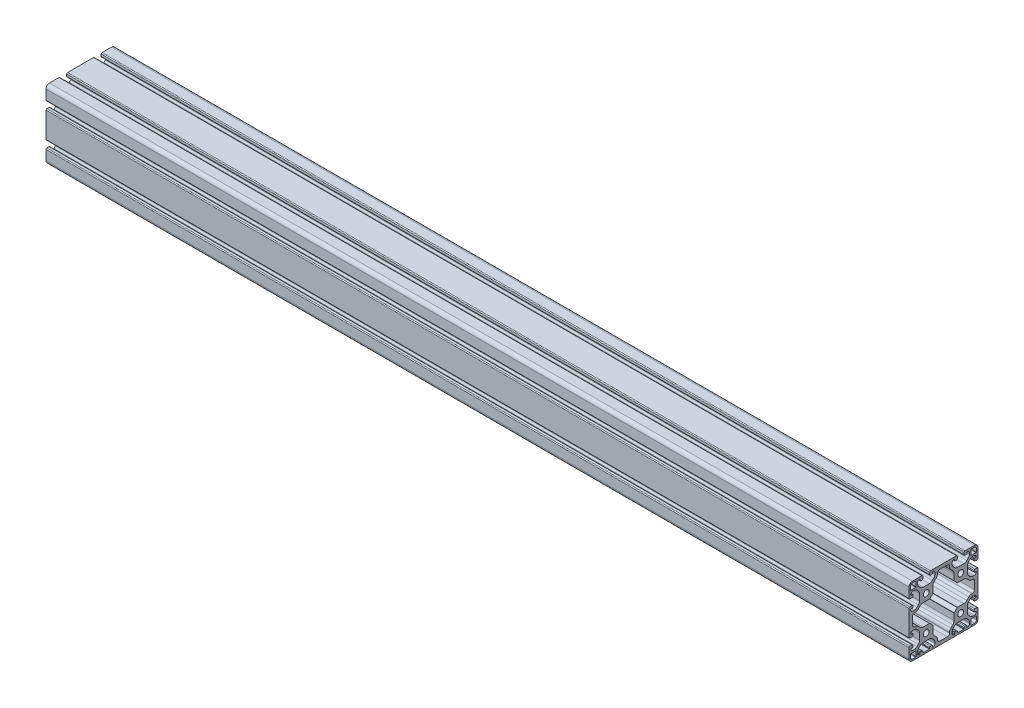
SolidWorks part; units mm, degrees
ref_plane "Ebene vorne" through (0, 0, 0) normal (0, 0, 1) x (1, 0, 0)
ref_plane "Ebene oben" through (0, 0, 0) normal (0, 1, 0) x (1, 0, 0)
ref_plane "Ebene rechts" through (0, 0, 0) normal (1, 0, 0) x (0, 0, -1)
sketch "Skizze1" plane through (0, 0, 0) normal (0, 1, 0) x (1, 0, 0)
  line L0 (0, 0) -> (1000, 0)
  dimension "D1" = 1000
other "Strukturbauteil1"
ref_plane "Ebene1" through (0, 0, 0) normal (1, 0, 0) x (0, 0, -1)
sketch "Skizze14" plane through (0, 0, 0) normal (1, 0, 0) x (0, 0, -1)
  line L0 (-37.5, -23.6736) -> (-39, -23.6736)
  line L1 (-37.5, -15.6736) -> (-39, -15.6736)
  line L2 (-37.5, 23.7652) -> (-39, 23.7652)
  line L3 (-37.5, 15.7652) -> (-39, 15.7652)
  line L4 (-40, -24.6736) -> (-40, -36)
  line L5 (-40, 14.7652) -> (-40, -14.6736)
  line L8 (-38.2, 36) -> (-38.2, 32.3)
  line L9 (-32.3, 38.2) -> (-36, 38.2)
  line L10 (-31.8, 32.3) -> (-31.8, 37.7)
  line L11 (-37.7, 31.8) -> (-32.3, 31.8)
  line L24 (-36, -26.6736) -> (-37.5, -26.6736)
  line L25 (-35.5, -24.6736) -> (-35.5, -26.1736)
  line L26 (-37.5, -23.6736) -> (-36.5, -23.6736)
  line L28 (-36.5, -15.6736) -> (-37.5, -15.6736)
  line L29 (-35.5, -13.1736) -> (-35.5, -14.6736)
  line L30 (-37.5, -12.6736) -> (-36, -12.6736)
  line L31 (-34.1924, -9.6736) -> (-35.5, -9.6736)
  line L120 (-36, -40) -> (36, -40)
  line L121 (40, -36) -> (40, -25)
  line L122 (39, -24) -> (36.5, -24)
  line L123 (35.5, -25) -> (35.5, -26.5)
  line L124 (36, -27) -> (37.55, -27)
  line L125 (38, -27.45) -> (38, -27.5)
  line L126 (35.5, -30) -> (34.1924, -30)
  line L127 (30.6569, -28.5355) -> (29.2145, -27.0931)
  line L128 (27.75, -23.5576) -> (27.75, -16.4424)
  line L129 (29.2145, -12.9069) -> (30.6569, -11.4645)
  line L130 (34.1924, -10) -> (35.5, -10)
  line L131 (38, -12.5) -> (38, -12.55)
  line L132 (37.55, -13) -> (36, -13)
  line L133 (35.5, -13.5) -> (35.5, -15)
  line L134 (36.5, -16) -> (39, -16)
  line L135 (40, -15) -> (40, 15)
  line L136 (39, 16) -> (36.5, 16)
  line L137 (35.5, 15) -> (35.5, 13.5)
  line L138 (36, 13) -> (37.55, 13)
  line L139 (38, 12.55) -> (38, 12.5)
  line L140 (35.5, 10) -> (34.1924, 10)
  line L141 (30.6569, 11.4645) -> (29.2145, 12.9069)
  line L142 (27.75, 16.4424) -> (27.75, 23.5576)
  line L143 (29.2145, 27.0931) -> (30.6569, 28.5355)
  line L144 (34.1924, 30) -> (35.5, 30)
  line L145 (38, 27.5) -> (38, 27.45)
  line L146 (37.55, 27) -> (36, 27)
  line L147 (35.5, 26.5) -> (35.5, 25)
  line L148 (36.5, 24) -> (39, 24)
  line L149 (40, 25) -> (40, 36)
  line L150 (36, 40) -> (25, 40)
  line L151 (24, 39) -> (24, 36.5)
  line L152 (25, 35.5) -> (26.5, 35.5)
  line L153 (27, 36) -> (27, 37.55)
  line L154 (27.45, 38) -> (27.5, 38)
  line L155 (30, 35.5) -> (30, 34.1924)
  line L156 (28.5355, 30.6569) -> (27.0931, 29.2145)
  line L157 (23.5576, 27.75) -> (16.4424, 27.75)
  line L158 (12.9069, 29.2145) -> (11.4645, 30.6569)
  line L159 (10, 34.1924) -> (10, 35.5)
  line L160 (12.5, 38) -> (12.55, 38)
  line L161 (13, 37.55) -> (13, 36)
  line L162 (13.5, 35.5) -> (15, 35.5)
  line L163 (16, 36.5) -> (16, 39)
  line L164 (15, 40) -> (-15, 40)
  line L165 (-16, 39) -> (-16, 36.5)
  line L166 (-15, 35.5) -> (-13.5, 35.5)
  line L167 (-13, 36) -> (-13, 37.55)
  line L168 (-12.55, 38) -> (-12.5, 38)
  line L169 (-10, 35.5) -> (-10, 34.1924)
  line L170 (-11.4645, 30.6569) -> (-12.9069, 29.2145)
  line L171 (-16.4424, 27.75) -> (-23.5576, 27.75)
  line L172 (-27.0931, 29.2145) -> (-28.5355, 30.6569)
  line L173 (-30, 34.1924) -> (-30, 35.5)
  line L174 (-27.5, 38) -> (-27.45, 38)
  line L175 (-27, 37.55) -> (-27, 36)
  line L176 (-26.5, 35.5) -> (-25, 35.5)
  line L177 (-24, 36.5) -> (-24, 39)
  line L178 (-25, 40) -> (-36, 40)
  line L179 (-40, 36) -> (-40, 24.7652)
  line L184 (-32.9497, 7) -> (-33.5, 7)
  line L185 (-27.0931, 10.7855) -> (-29.4142, 8.4645)
  line L186 (-16.2414, 12.25) -> (-23.5576, 12.25)
  line L187 (-12.3964, 15.8878) -> (-15.8878, 12.3964)
  line L188 (-12.25, 23.5576) -> (-12.25, 16.2414)
  line L189 (-8.4645, 29.4142) -> (-10.7855, 27.0931)
  line L190 (-7, 33.5) -> (-7, 32.9497)
  line L191 (4.5, 36) -> (-4.5, 36)
  line L192 (7, 32.9497) -> (7, 33.5)
  line L193 (10.7855, 27.0931) -> (8.4645, 29.4142)
  line L194 (12.25, 16.2414) -> (12.25, 23.5576)
  line L195 (15.8878, 12.3964) -> (12.3964, 15.8878)
  line L196 (23.5576, 12.25) -> (16.2414, 12.25)
  line L197 (29.4142, 8.4645) -> (27.0931, 10.7855)
  line L198 (33.5, 7) -> (32.9497, 7)
  line L199 (36, -4.5) -> (36, 4.5)
  line L200 (32.9497, -7) -> (33.5, -7)
  line L201 (27.0931, -10.7855) -> (29.4142, -8.4645)
  line L202 (16.2414, -12.25) -> (23.5576, -12.25)
  line L203 (12.3964, -15.8878) -> (15.8878, -12.3964)
  line L204 (12.25, -23.5576) -> (12.25, -16.2414)
  line L205 (8.4645, -29.4142) -> (10.7855, -27.0931)
  line L206 (7, -33.5) -> (7, -32.9497)
  line L207 (-4.5, -36) -> (4.5, -36)
  line L208 (-7, -32.9497) -> (-7, -33.5)
  line L209 (-10.7855, -27.0931) -> (-8.4645, -29.4142)
  line L210 (-12.25, -16.2414) -> (-12.25, -23.5576)
  line L211 (-15.8878, -12.3964) -> (-12.3964, -15.8878)
  line L212 (-23.5576, -12.25) -> (-16.2414, -12.25)
  line L213 (-29.4142, -8.4645) -> (-27.0931, -10.7855)
  line L214 (-33.5, -7) -> (-32.9497, -7)
  line L215 (-36, 4.5) -> (-36, -4.5)
  line L216 (-29.2145, -12.5805) -> (-30.6569, -11.1381)
  line L217 (-27.75, -23.2312) -> (-27.75, -16.116)
  line L218 (-30.6569, -28.2091) -> (-29.2145, -26.7668)
  line L219 (-35.5, -29.6736) -> (-34.1924, -29.6736)
  line L232 (-36, 12.7652) -> (-37.5, 12.7652)
  line L233 (-35.5, 14.7652) -> (-35.5, 13.2652)
  line L234 (-37.5, 15.7652) -> (-36.5, 15.7652)
  line L236 (-36.5, 23.7652) -> (-37.5, 23.7652)
  line L237 (-35.5, 26.2652) -> (-35.5, 24.7652)
  line L238 (-37.5, 26.7652) -> (-36, 26.7652)
  line L239 (-34.1924, 29.7652) -> (-35.5, 29.7652)
  line L240 (-29.2145, 26.8584) -> (-30.6569, 28.3008)
  line L241 (-27.75, 16.2076) -> (-27.75, 23.3229)
  line L242 (-30.6569, 11.2297) -> (-29.2145, 12.6721)
  line L243 (-35.5, 9.7652) -> (-34.1924, 9.7652)
  line L248 (-32.3, -31.8) -> (-37.7, -31.8)
  line L249 (-31.8, -37.7) -> (-31.8, -32.3)
  line L250 (-36, -38.2) -> (-32.3, -38.2)
  line L251 (-38.2, -32.3) -> (-38.2, -36)
  line L256 (31.8, -32.3) -> (31.8, -37.7)
  line L257 (37.7, -31.8) -> (32.3, -31.8)
  line L258 (38.2, -36) -> (38.2, -32.3)
  line L259 (32.3, -38.2) -> (36, -38.2)
  line L272 (10, -34.1924) -> (10, -35.5)
  line L273 (12.9069, -29.2145) -> (11.4645, -30.6569)
  line L274 (23.5576, -27.75) -> (16.4424, -27.75)
  line L275 (28.5355, -30.6569) -> (27.0931, -29.2145)
  line L276 (30, -35.5) -> (30, -34.1924)
  line L277 (27, -36) -> (27, -37.5)
  line L278 (25, -35.5) -> (26.5, -35.5)
  line L279 (24, -37.5) -> (24, -36.5)
  line L280 (16.5, -38) -> (23.5, -38)
  line L281 (16, -36.5) -> (16, -37.5)
  line L282 (13.5, -35.5) -> (15, -35.5)
  line L283 (13, -37.5) -> (13, -36)
  line L296 (-30, -34.1924) -> (-30, -35.5)
  line L297 (-27.0931, -29.2145) -> (-28.5355, -30.6569)
  line L298 (-16.4424, -27.75) -> (-23.5576, -27.75)
  line L299 (-11.4645, -30.6569) -> (-12.9069, -29.2145)
  line L300 (-10, -35.5) -> (-10, -34.1924)
  line L301 (-13, -36) -> (-13, -37.5)
  line L302 (-15, -35.5) -> (-13.5, -35.5)
  line L303 (-16, -37.5) -> (-16, -36.5)
  line L304 (-23.5, -38) -> (-16.5, -38)
  line L305 (-24, -36.5) -> (-24, -37.5)
  line L306 (-26.5, -35.5) -> (-25, -35.5)
  line L307 (-27, -37.5) -> (-27, -36)
  line L312 (31.8, 37.7) -> (31.8, 32.3)
  line L313 (36, 38.2) -> (32.3, 38.2)
  line L314 (38.2, 32.3) -> (38.2, 36)
  line L315 (32.3, 31.8) -> (37.7, 31.8)
  arc A0 (-39, 15.7652) -> (-40, 14.7652) centre (-39, 14.7652) ccw
  arc A1 (-39, 23.7652) -> (-40, 24.7652) centre (-39, 24.7652) cw
  circle A2 centre (20, 20) radius 3.4
  arc A3 (-39, -23.6736) -> (-40, -24.6736) centre (-39, -24.6736) ccw
  circle A4 centre (-20, 20) radius 3.4
  arc A5 (-39, -15.6736) -> (-40, -14.6736) centre (-39, -14.6736) cw
  circle A6 centre (-20, -20) radius 3.4
  circle A8 centre (20, -20) radius 3.4
  arc A16 (-38.2, 32.3) -> (-37.7, 31.8) centre (-37.7, 32.3) ccw
  arc A17 (-36, 38.2) -> (-38.2, 36) centre (-36, 36) ccw
  arc A18 (-31.8, 37.7) -> (-32.3, 38.2) centre (-32.3, 37.7) ccw
  arc A19 (-32.3, 31.8) -> (-31.8, 32.3) centre (-32.3, 32.3) ccw
  arc A120 (-40, -36) -> (-36, -40) centre (-36, -36) ccw
  arc A121 (36, -40) -> (40, -36) centre (36, -36) ccw
  arc A122 (40, -25) -> (39, -24) centre (39, -25) ccw
  arc A123 (36.5, -24) -> (35.5, -25) centre (36.5, -25) ccw
  arc A124 (35.5, -26.5) -> (36, -27) centre (36, -26.5) ccw
  arc A125 (38, -27.45) -> (37.55, -27) centre (37.55, -27.45) ccw
  arc A126 (35.5, -30) -> (38, -27.5) centre (35.5, -27.5) ccw
  arc A127 (30.6569, -28.5355) -> (34.1924, -30) centre (34.1924, -25) ccw
  arc A128 (27.75, -23.5576) -> (29.2145, -27.0931) centre (32.75, -23.5576) ccw
  arc A129 (29.2145, -12.9069) -> (27.75, -16.4424) centre (32.75, -16.4424) ccw
  arc A130 (34.1924, -10) -> (30.6569, -11.4645) centre (34.1924, -15) ccw
  arc A131 (38, -12.5) -> (35.5, -10) centre (35.5, -12.5) ccw
  arc A132 (37.55, -13) -> (38, -12.55) centre (37.55, -12.55) ccw
  arc A133 (36, -13) -> (35.5, -13.5) centre (36, -13.5) ccw
  arc A134 (35.5, -15) -> (36.5, -16) centre (36.5, -15) ccw
  arc A135 (39, -16) -> (40, -15) centre (39, -15) ccw
  arc A136 (40, 15) -> (39, 16) centre (39, 15) ccw
  arc A137 (36.5, 16) -> (35.5, 15) centre (36.5, 15) ccw
  arc A138 (35.5, 13.5) -> (36, 13) centre (36, 13.5) ccw
  arc A139 (38, 12.55) -> (37.55, 13) centre (37.55, 12.55) ccw
  arc A140 (35.5, 10) -> (38, 12.5) centre (35.5, 12.5) ccw
  arc A141 (30.6569, 11.4645) -> (34.1924, 10) centre (34.1924, 15) ccw
  arc A142 (27.75, 16.4424) -> (29.2145, 12.9069) centre (32.75, 16.4424) ccw
  arc A143 (29.2145, 27.0931) -> (27.75, 23.5576) centre (32.75, 23.5576) ccw
  arc A144 (34.1924, 30) -> (30.6569, 28.5355) centre (34.1924, 25) ccw
  arc A145 (38, 27.5) -> (35.5, 30) centre (35.5, 27.5) ccw
  arc A146 (37.55, 27) -> (38, 27.45) centre (37.55, 27.45) ccw
  arc A147 (36, 27) -> (35.5, 26.5) centre (36, 26.5) ccw
  arc A148 (35.5, 25) -> (36.5, 24) centre (36.5, 25) ccw
  arc A149 (39, 24) -> (40, 25) centre (39, 25) ccw
  arc A150 (40, 36) -> (36, 40) centre (36, 36) ccw
  arc A151 (25, 40) -> (24, 39) centre (25, 39) ccw
  arc A152 (24, 36.5) -> (25, 35.5) centre (25, 36.5) ccw
  arc A153 (26.5, 35.5) -> (27, 36) centre (26.5, 36) ccw
  arc A154 (27.45, 38) -> (27, 37.55) centre (27.45, 37.55) ccw
  arc A155 (30, 35.5) -> (27.5, 38) centre (27.5, 35.5) ccw
  arc A156 (28.5355, 30.6569) -> (30, 34.1924) centre (25, 34.1924) ccw
  arc A157 (23.5576, 27.75) -> (27.0931, 29.2145) centre (23.5576, 32.75) ccw
  arc A158 (12.9069, 29.2145) -> (16.4424, 27.75) centre (16.4424, 32.75) ccw
  arc A159 (10, 34.1924) -> (11.4645, 30.6569) centre (15, 34.1924) ccw
  arc A160 (12.5, 38) -> (10, 35.5) centre (12.5, 35.5) ccw
  arc A161 (13, 37.55) -> (12.55, 38) centre (12.55, 37.55) ccw
  arc A162 (13, 36) -> (13.5, 35.5) centre (13.5, 36) ccw
  arc A163 (15, 35.5) -> (16, 36.5) centre (15, 36.5) ccw
  arc A164 (16, 39) -> (15, 40) centre (15, 39) ccw
  arc A165 (-15, 40) -> (-16, 39) centre (-15, 39) ccw
  arc A166 (-16, 36.5) -> (-15, 35.5) centre (-15, 36.5) ccw
  arc A167 (-13.5, 35.5) -> (-13, 36) centre (-13.5, 36) ccw
  arc A168 (-12.55, 38) -> (-13, 37.55) centre (-12.55, 37.55) ccw
  arc A169 (-10, 35.5) -> (-12.5, 38) centre (-12.5, 35.5) ccw
  arc A170 (-11.4645, 30.6569) -> (-10, 34.1924) centre (-15, 34.1924) ccw
  arc A171 (-16.4424, 27.75) -> (-12.9069, 29.2145) centre (-16.4424, 32.75) ccw
  arc A172 (-27.0931, 29.2145) -> (-23.5576, 27.75) centre (-23.5576, 32.75) ccw
  arc A173 (-30, 34.1924) -> (-28.5355, 30.6569) centre (-25, 34.1924) ccw
  arc A174 (-27.5, 38) -> (-30, 35.5) centre (-27.5, 35.5) ccw
  arc A175 (-27, 37.55) -> (-27.45, 38) centre (-27.45, 37.55) ccw
  arc A176 (-27, 36) -> (-26.5, 35.5) centre (-26.5, 36) ccw
  arc A177 (-25, 35.5) -> (-24, 36.5) centre (-25, 36.5) ccw
  arc A178 (-24, 39) -> (-25, 40) centre (-25, 39) ccw
  arc A179 (-36, 40) -> (-40, 36) centre (-36, 36) ccw
  arc A186 (-33.5, 7) -> (-36, 4.5) centre (-33.5, 4.5) ccw
  arc A187 (-32.9497, 7) -> (-29.4142, 8.4645) centre (-32.9497, 12) ccw
  arc A188 (-23.5576, 12.25) -> (-27.0931, 10.7855) centre (-23.5576, 7.25) ccw
  arc A189 (-16.2414, 12.25) -> (-15.8878, 12.3964) centre (-16.2414, 12.75) ccw
  arc A190 (-12.3964, 15.8878) -> (-12.25, 16.2414) centre (-12.75, 16.2414) ccw
  arc A191 (-10.7855, 27.0931) -> (-12.25, 23.5576) centre (-7.25, 23.5576) ccw
  arc A192 (-8.4645, 29.4142) -> (-7, 32.9497) centre (-12, 32.9497) ccw
  arc A193 (-4.5, 36) -> (-7, 33.5) centre (-4.5, 33.5) ccw
  arc A194 (7, 33.5) -> (4.5, 36) centre (4.5, 33.5) ccw
  arc A195 (7, 32.9497) -> (8.4645, 29.4142) centre (12, 32.9497) ccw
  arc A196 (12.25, 23.5576) -> (10.7855, 27.0931) centre (7.25, 23.5576) ccw
  arc A197 (12.25, 16.2414) -> (12.3964, 15.8878) centre (12.75, 16.2414) ccw
  arc A198 (15.8878, 12.3964) -> (16.2414, 12.25) centre (16.2414, 12.75) ccw
  arc A199 (27.0931, 10.7855) -> (23.5576, 12.25) centre (23.5576, 7.25) ccw
  arc A200 (29.4142, 8.4645) -> (32.9497, 7) centre (32.9497, 12) ccw
  arc A201 (36, 4.5) -> (33.5, 7) centre (33.5, 4.5) ccw
  arc A202 (33.5, -7) -> (36, -4.5) centre (33.5, -4.5) ccw
  arc A203 (32.9497, -7) -> (29.4142, -8.4645) centre (32.9497, -12) ccw
  arc A204 (23.5576, -12.25) -> (27.0931, -10.7855) centre (23.5576, -7.25) ccw
  arc A205 (16.2414, -12.25) -> (15.8878, -12.3964) centre (16.2414, -12.75) ccw
  arc A206 (12.3964, -15.8878) -> (12.25, -16.2414) centre (12.75, -16.2414) ccw
  arc A207 (10.7855, -27.0931) -> (12.25, -23.5576) centre (7.25, -23.5576) ccw
  arc A208 (8.4645, -29.4142) -> (7, -32.9497) centre (12, -32.9497) ccw
  arc A209 (4.5, -36) -> (7, -33.5) centre (4.5, -33.5) ccw
  arc A210 (-7, -33.5) -> (-4.5, -36) centre (-4.5, -33.5) ccw
  arc A211 (-7, -32.9497) -> (-8.4645, -29.4142) centre (-12, -32.9497) ccw
  arc A212 (-12.25, -23.5576) -> (-10.7855, -27.0931) centre (-7.25, -23.5576) ccw
  arc A213 (-12.25, -16.2414) -> (-12.3964, -15.8878) centre (-12.75, -16.2414) ccw
  arc A214 (-15.8878, -12.3964) -> (-16.2414, -12.25) centre (-16.2414, -12.75) ccw
  arc A215 (-27.0931, -10.7855) -> (-23.5576, -12.25) centre (-23.5576, -7.25) ccw
  arc A216 (-29.4142, -8.4645) -> (-32.9497, -7) centre (-32.9497, -12) ccw
  arc A217 (-36, -4.5) -> (-33.5, -7) centre (-33.4973, -4.4973) ccw
  arc A220 (-37.5, -26.6736) -> (-38, -27.1736) centre (-37.5, -27.1736) ccw
  arc A221 (-36, -26.6736) -> (-35.5, -26.1736) centre (-36, -26.1736) ccw
  arc A222 (-35.5, -24.6736) -> (-36.5, -23.6736) centre (-36.5, -24.6736) ccw
  arc A225 (-36.5, -15.6736) -> (-35.5, -14.6736) centre (-36.5, -14.6736) ccw
  arc A226 (-35.5, -13.1736) -> (-36, -12.6736) centre (-36, -13.1736) ccw
  arc A227 (-38, -12.1736) -> (-37.5, -12.6736) centre (-37.5, -12.1736) ccw
  arc A228 (-35.5, -9.6736) -> (-38, -12.1736) centre (-35.5, -12.1736) ccw
  arc A229 (-30.6569, -11.1381) -> (-34.1924, -9.6736) centre (-34.1924, -14.6736) ccw
  arc A230 (-27.75, -16.116) -> (-29.2145, -12.5805) centre (-32.75, -16.116) ccw
  arc A231 (-29.2145, -26.7668) -> (-27.75, -23.2312) centre (-32.75, -23.2312) ccw
  arc A232 (-34.1924, -29.6736) -> (-30.6569, -28.2091) centre (-34.1924, -24.6736) ccw
  arc A233 (-38, -27.1736) -> (-35.5, -29.6736) centre (-35.5, -27.1736) ccw
  arc A248 (-37.5, 12.7652) -> (-38, 12.2652) centre (-37.5, 12.2652) ccw
  arc A249 (-36, 12.7652) -> (-35.5, 13.2652) centre (-36, 13.2652) ccw
  arc A250 (-35.5, 14.7652) -> (-36.5, 15.7652) centre (-36.5, 14.7652) ccw
  arc A253 (-36.5, 23.7652) -> (-35.5, 24.7652) centre (-36.5, 24.7652) ccw
  arc A254 (-35.5, 26.2652) -> (-36, 26.7652) centre (-36, 26.2652) ccw
  arc A255 (-38, 27.2652) -> (-37.5, 26.7652) centre (-37.5, 27.2652) ccw
  arc A256 (-35.5, 29.7652) -> (-38, 27.2652) centre (-35.5, 27.2652) ccw
  arc A257 (-30.6569, 28.3008) -> (-34.1924, 29.7652) centre (-34.1924, 24.7652) ccw
  arc A258 (-27.75, 23.3229) -> (-29.2145, 26.8584) centre (-32.75, 23.3229) ccw
  arc A259 (-29.2145, 12.6721) -> (-27.75, 16.2076) centre (-32.75, 16.2076) ccw
  arc A260 (-34.1924, 9.7652) -> (-30.6569, 11.2297) centre (-34.1924, 14.7652) ccw
  arc A261 (-38, 12.2652) -> (-35.5, 9.7652) centre (-35.5, 12.2652) ccw
  arc A264 (-37.7, -31.8) -> (-38.2, -32.3) centre (-37.7, -32.3) ccw
  arc A265 (-31.8, -32.3) -> (-32.3, -31.8) centre (-32.3, -32.3) ccw
  arc A266 (-32.3, -38.2) -> (-31.8, -37.7) centre (-32.3, -37.7) ccw
  arc A267 (-38.2, -36) -> (-36, -38.2) centre (-36, -36) ccw
  arc A272 (31.8, -37.7) -> (32.3, -38.2) centre (32.3, -37.7) ccw
  arc A273 (32.3, -31.8) -> (31.8, -32.3) centre (32.3, -32.3) ccw
  arc A274 (38.2, -32.3) -> (37.7, -31.8) centre (37.7, -32.3) ccw
  arc A275 (36, -38.2) -> (38.2, -36) centre (36, -36) ccw
  arc A292 (10, -35.5) -> (12.5, -38) centre (12.5, -35.5) ccw
  arc A293 (11.4645, -30.6569) -> (10, -34.1924) centre (15, -34.1924) ccw
  arc A294 (16.4424, -27.75) -> (12.9069, -29.2145) centre (16.4424, -32.75) ccw
  arc A295 (27.0931, -29.2145) -> (23.5576, -27.75) centre (23.5576, -32.75) ccw
  arc A296 (30, -34.1924) -> (28.5355, -30.6569) centre (25, -34.1924) ccw
  arc A297 (27.5, -38) -> (30, -35.5) centre (27.5, -35.5) ccw
  arc A298 (27, -37.5) -> (27.5, -38) centre (27.5, -37.5) ccw
  arc A299 (27, -36) -> (26.5, -35.5) centre (26.5, -36) ccw
  arc A300 (25, -35.5) -> (24, -36.5) centre (25, -36.5) ccw
  arc A301 (23.5, -38) -> (24, -37.5) centre (23.5, -37.5) ccw
  arc A302 (16, -37.5) -> (16.5, -38) centre (16.5, -37.5) ccw
  arc A303 (16, -36.5) -> (15, -35.5) centre (15, -36.5) ccw
  arc A304 (13.5, -35.5) -> (13, -36) centre (13.5, -36) ccw
  arc A305 (12.5, -38) -> (13, -37.5) centre (12.5, -37.5) ccw
  arc A320 (-30, -35.5) -> (-27.5, -38) centre (-27.5, -35.5) ccw
  arc A321 (-28.5355, -30.6569) -> (-30, -34.1924) centre (-25, -34.1924) ccw
  arc A322 (-23.5576, -27.75) -> (-27.0931, -29.2145) centre (-23.5576, -32.75) ccw
  arc A323 (-12.9069, -29.2145) -> (-16.4424, -27.75) centre (-16.4424, -32.75) ccw
  arc A324 (-10, -34.1924) -> (-11.4645, -30.6569) centre (-15, -34.1924) ccw
  arc A325 (-12.5, -38) -> (-10, -35.5) centre (-12.5, -35.5) ccw
  arc A326 (-13, -37.5) -> (-12.5, -38) centre (-12.5, -37.5) ccw
  arc A327 (-13, -36) -> (-13.5, -35.5) centre (-13.5, -36) ccw
  arc A328 (-15, -35.5) -> (-16, -36.5) centre (-15, -36.5) ccw
  arc A329 (-16.5, -38) -> (-16, -37.5) centre (-16.5, -37.5) ccw
  arc A330 (-24, -37.5) -> (-23.5, -38) centre (-23.5, -37.5) ccw
  arc A331 (-24, -36.5) -> (-25, -35.5) centre (-25, -36.5) ccw
  arc A332 (-26.5, -35.5) -> (-27, -36) centre (-26.5, -36) ccw
  arc A333 (-27.5, -38) -> (-27, -37.5) centre (-27.5, -37.5) ccw
  arc A336 (31.8, 32.3) -> (32.3, 31.8) centre (32.3, 32.3) ccw
  arc A337 (32.3, 38.2) -> (31.8, 37.7) centre (32.3, 37.7) ccw
  arc A338 (38.2, 36) -> (36, 38.2) centre (36, 36) ccw
  arc A339 (37.7, 31.8) -> (38.2, 32.3) centre (37.7, 32.3) ccw
  point P0 (-40, 14.7652)
  point P8 (40, -20)
  point P36 (40, 20)
  point P63 (0, 0)
  point P89 (20, 40)
  point P242 (-39, 15.7652)
  point P249 (-39, 23.7652)
  point P320 (-40, 24.7652)
  point P326 (-39, -23.6736)
  point P331 (-40, -24.6736)
  point P332 (-39, -15.6736)
  point P371 (-40, -14.6736)
  point P509 (-20, 40)
  point P510 (-40, 20)
  point P511 (-40, -20)
  point P512 (-20, -40)
  point P513 (20, -40)
  point P514 (-40, -40)
  point P515 (40, -40)
  point P516 (40, 40)
  point P517 (-40, 40)
  point P518 (-40, 0.0458)
  point P519 (40, 0)
  point P520 (0, 40)
  point P521 (0, -40)
  point P522 (0, 0)
  dimension "D1" = 1
  dimension "D2" = 1
  dimension "D3" = 1
  dimension "D4" = 1
  dimension "D5" = 1
  dimension "D6" = 1
  dimension "D7" = 1
  dimension "D8" = 1
  dimension "D9" = 1
